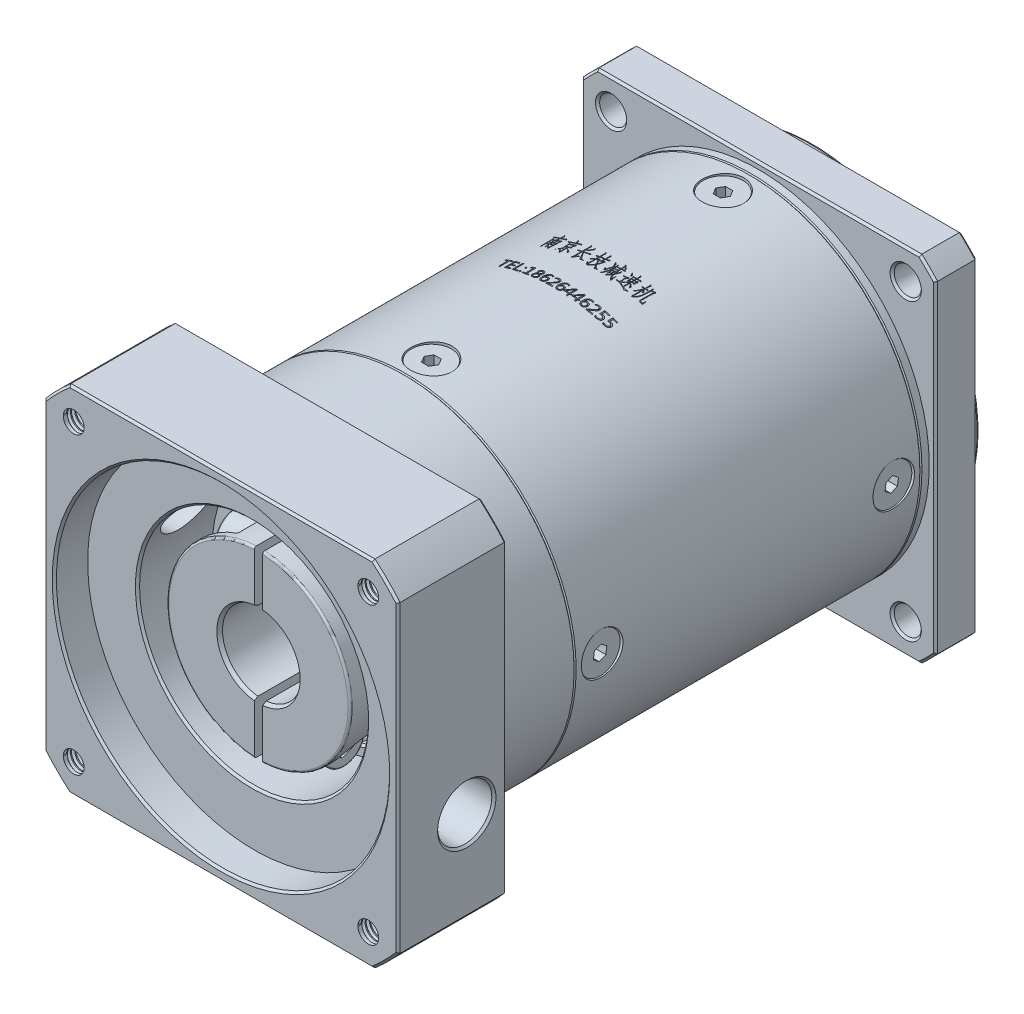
SolidWorks part; units mm, degrees
ref_plane "前视基准面" through (0, 0, 0) normal (0, 0, 1) x (1, 0, 0)
ref_plane "上视基准面" through (0, 0, 0) normal (0, 1, 0) x (1, 0, 0)
ref_plane "右视基准面" through (0, 0, 0) normal (1, 0, 0) x (0, 0, -1)
imported_body "19-80-100-M6-1-solid1"
imported_body "19-80-100-M6-1-solid2"
imported_body "19-80-100-M6-1-solid3"
imported_body "19-80-100-M6-1-solid4"
imported_body "ZF80-K15-L3-6-solid1"
imported_body "ZF80-K15-L3-6-solid2"
imported_body "ZF80-K15-L3-6-solid3"
imported_body "ZF80-K15-L3-6-solid4"
imported_body "ZF80-K15-L3-6-solid5"
imported_body "ZF80-K15-L3-6-solid6"
imported_body "ZF80-K15-L3-6-solid7"
imported_body "ZF80-K15-L3-6-solid8"
imported_body "ZF80-K15-L3-6-solid9"
sketch "草图1" plane through (0, 0, -80.7927) normal (0, 0, -1) x (-1, 0, 0)
  circle A0 centre (93.2642, 24.5962) radius 10.7526
  dimension "D1" = 21.5052
extrude "凸台-拉伸1" add sketch "草图1" along normal blind 5
